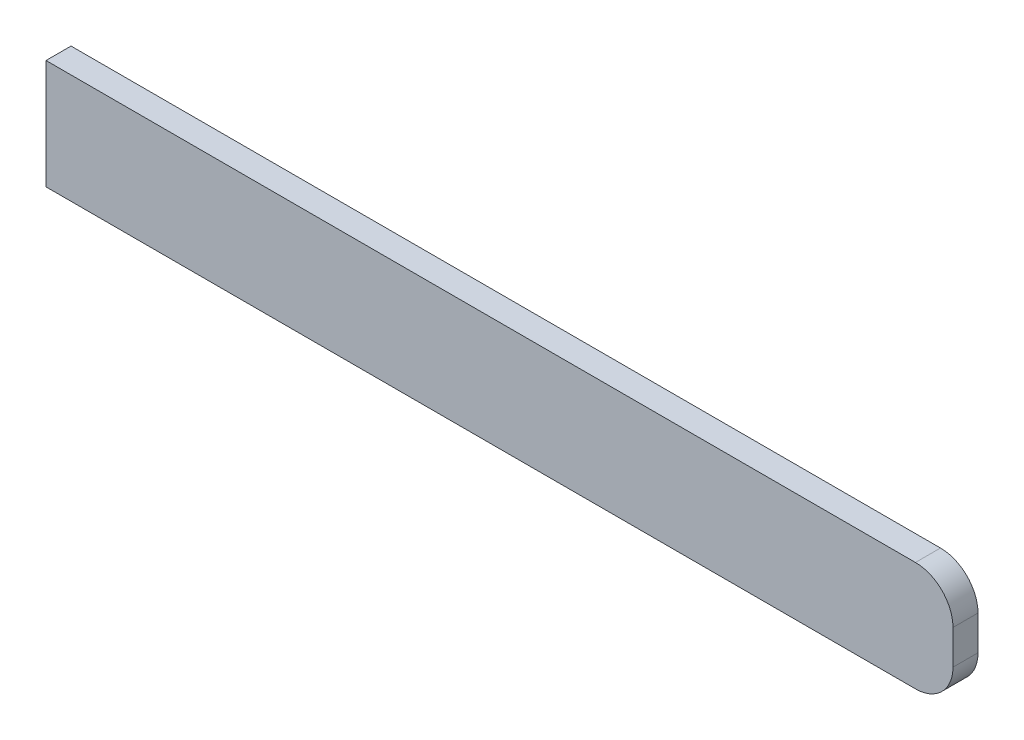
SolidWorks part; units mm, degrees
ref_plane "Přední" through (0, 0, 0) normal (0, 0, 1) x (1, 0, 0)
ref_plane "Horní" through (0, 0, 0) normal (0, 1, 0) x (1, 0, 0)
ref_plane "Pravá" through (0, 0, 0) normal (1, 0, 0) x (0, 0, -1)
sketch "Skica1" plane through (0, 0, 0) normal (0, 0, 1) x (1, 0, 0)
  line L0 (145, 17.5) -> (-145, -17.5) construction
  line L1 (-145, 17.5) -> (145, 17.5)
  line L2 (-145, 17.5) -> (-145, -17.5)
  line L3 (-145, -17.5) -> (145, -17.5)
  line L4 (145, 17.5) -> (145, -17.5)
  dimension "D1" = 35
  dimension "D2" = 290
extrude "Vysunout1" add sketch "Skica1" along normal blind 8
fillet "Zaoblit1" radius 12 2 edges at (145, -17.5, 4) (145, 17.5, 4)
